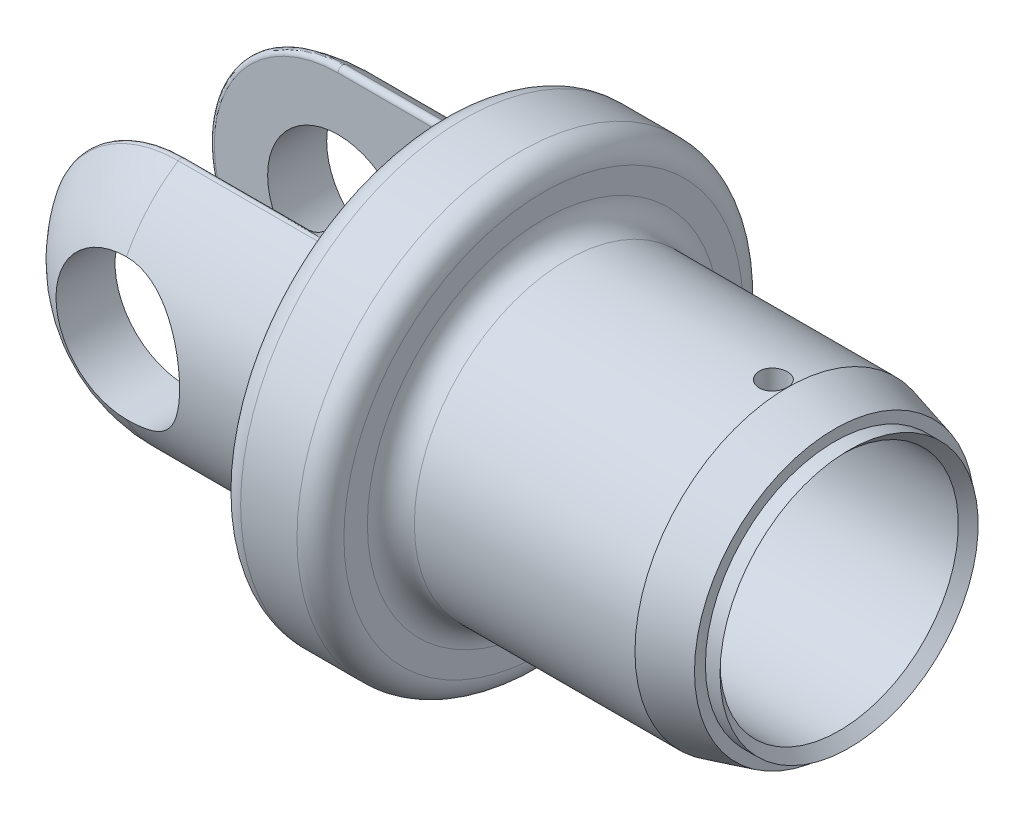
SolidWorks part; units mm, degrees
ref_plane "Plan de face" through (0, 0, 0) normal (0, 0, 1) x (1, 0, 0)
ref_plane "Plan de dessus" through (0, 0, 0) normal (0, 1, 0) x (1, 0, 0)
ref_plane "Plan de droite" through (0, 0, 0) normal (1, 0, 0) x (0, 0, -1)
sketch "Esquisse1" plane through (0, 0, 0) normal (0, 0, 1) x (1, 0, 0)
  line L1 (214.9999, 25.385) -> (217.1149, 27.5)
  line L2 (138.9999, 19.5) -> (138.9999, 0)
  line L4 (59.5, 0) -> (138.9999, 0)
  line L1084 (203.9999, 32.5) -> (157, 32.5)
  line L1099 (125, 32.5) -> (92, 32.5)
  line L1137 (144.9999, 21.5) -> (151.7289, 25.385)
  line L1142 (130, 37.5) -> (130, 42.5)
  line L1143 (147, 47.5) -> (135, 47.5)
  line L1144 (140.9999, 21.5) -> (144.9999, 21.5)
  line L1145 (138.9999, 19.5) -> (140.9999, 21.5)
  line L1151 (152, 37.5) -> (152, 42.5)
  line L1321 (213.9999, 27.5) -> (217.1149, 27.5)
  line L1338 (214, 27.5) -> (214, 29.8205)
  line L1339 (204, 32.5) -> (214, 29.8205)
  line L1340 (204, 32.5) -> (203.9999, 32.5)
  line L1343 (214.9999, 25.385) -> (151.7289, 25.385)
  arc A156 (92, 32.5) -> (59.5, 0) centre (92, 0) ccw
  arc A205 (152, 42.5) -> (147, 47.5) centre (147, 42.5) ccw
  arc A207 (125, 32.5) -> (130, 37.5) centre (125, 37.5) ccw
  arc A208 (135, 47.5) -> (130, 42.5) centre (135, 42.5) ccw
  arc A211 (152, 37.5) -> (157, 32.5) centre (157, 37.5) ccw
revolve "Révolution2" add sketch "Esquisse1" angle 360 about L4
sketch "Esquisse2" plane through (0, 0, 0) normal (0, 1, 0) x (1, 0, 0)
  line L0 (92, 0) -> (226.4571, 0) construction
  line L1 (92, -32.5) -> (92, 32.5) construction
  line L2 (217.1149, -27.5) -> (217.1149, 27.5) construction
  circle A0 centre (200.9949, 0) radius 3
  dimension "D2" = 6
  dimension "D1" = 16.12
extrude "Extrusion1" cut sketch "Esquisse2" along normal blind 82
sketch "Esquisse3" plane through (0, 0, 0) normal (0, 0, 1) x (1, 0, 0)
  line L0 (92, 32.5) -> (92, -32.5) construction
  circle A0 centre (92, 0) radius 15
  dimension "D1" = 30
extrude "Extrusion2" cut sketch "Esquisse3" against normal mid plane 82
sketch "Esquisse4" plane through (0, 0, 0) normal (0, 1, 0) x (1, 0, 0)
  line L0 (125, 0) -> (50.9993, 0) construction
  line L1 (125, -32.5) -> (125, 32.5) construction
  line L2 (117, 16.25) -> (55.9286, 16.25)
  line L4 (117, 16.25) -> (117, -16.25)
  line L5 (117, -16.25) -> (55.9286, -16.25)
  line L6 (55.9286, 16.25) -> (55.9286, -16.25)
  line L7 (92, -28.8314) -> (92, 28.8314) construction
  dimension "D1" = 25
  dimension "D2" = 32.5
extrude "Extrusion3" cut sketch "Esquisse4" against normal mid plane 94
fillet "Congé1" radius 10 2 edges at (117, 32.5, 0) (117, -32.5, 0)
fillet "Congé2" radius 1 10 edges at (108.5, -28.1458, 16.25) (108.5, 28.1458, 16.25) (108.5, -28.1458, -16.25) (108.5, 28.1458, -16.25) (63.8542, 0, 16.25) (63.8542, 0, -16.25)
fillet "Congé3" radius 3 14 edges at (122.62, -26.9917, 16.4773) (117.7201, -20.7554, 16.25) (121.8895, 26.3588, 16.7479) (123.6291, 27.2685, 16.8388) (118.4676, 22.6165, 16.25) (121.8895, -26.3588, -16.7479) (123.6291, -27.2685, -16.8388) (118.4676, -22.6165, -16.25) (122.62, 26.9917, -16.4773) (117.7201, 20.7554, -16.25) (117, 0, 16.25) (117, 0, -16.25)
